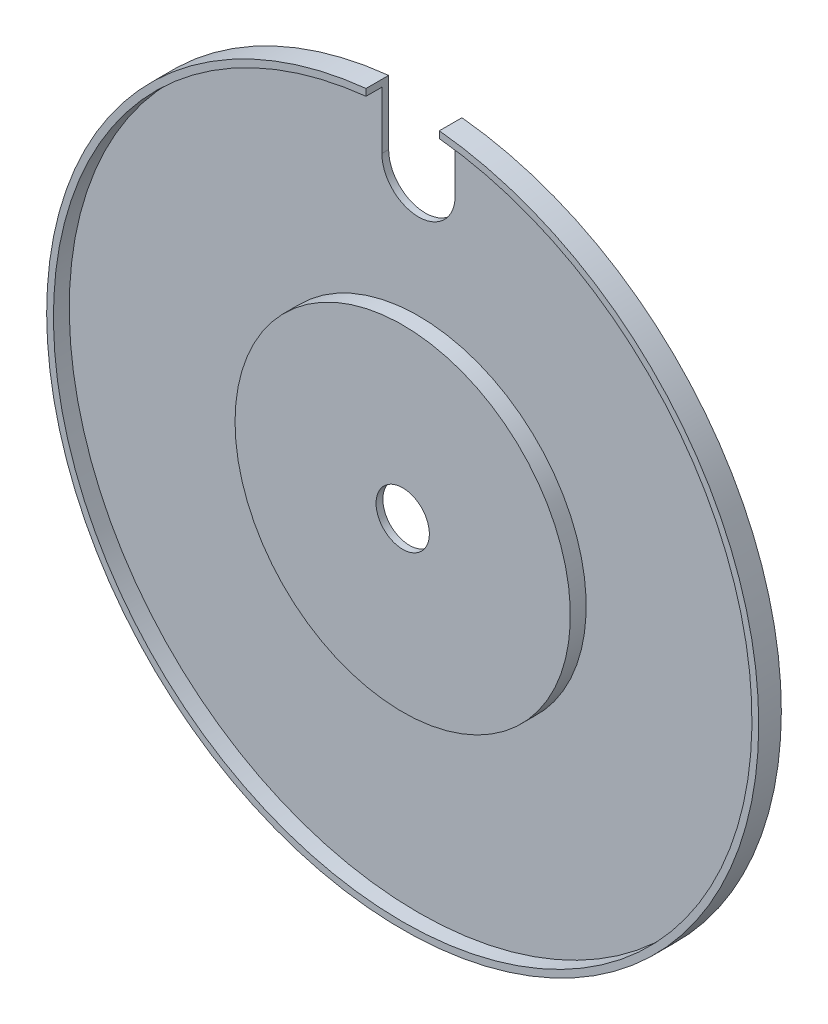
SolidWorks part; units mm, degrees
ref_plane "Front Plane" through (0, 0, 0) normal (0, 0, 1) x (1, 0, 0)
ref_plane "Top Plane" through (0, 0, 0) normal (0, 1, 0) x (1, 0, 0)
ref_plane "Right Plane" through (0, 0, 0) normal (1, 0, 0) x (0, 0, -1)
sketch "Sketch1" plane through (0, 0, 0) normal (0, 0, 1) x (1, 0, 0)
  line L0 (0, 32.5772) -> (0, 0) construction
  line L1 (-4.1185, 32.5772) -> (-4.1185, 44.8616)
  line L2 (-4.1185, 44.8616) -> (4.1185, 44.8616)
  line L3 (4.1185, 44.8616) -> (4.1185, 32.5772)
  circle A0 centre (0, 0) radius 40.005 construction
  circle A1 centre (0, 0) radius 2.9925
  arc A3 (-4.1185, 32.5772) -> (4.1185, 32.5772) centre (0, 32.5772) ccw
  dimension "D2" = 80.01
  dimension "D1" = 32.5772
sketch "Sketch2" plane through (0, 0, 0) normal (0, 1, 0) x (1, 0, 0)
  line L0 (-18.077, -1.1732) -> (0, -1.1732)
  line L1 (-18.077, 0.6048) -> (-18.077, -1.1732)
  line L2 (-40.005, 0.6048) -> (-40.005, -1.9352)
  line L3 (-40.005, -1.9352) -> (-18.077, -1.9352)
  line L4 (0, -1.1732) -> (0, -1.9352)
  line L5 (0, -1.9352) -> (-18.077, -1.9352)
  line L9 (-18.077, 0.6048) -> (-40.005, 0.6048)
  dimension "D1" = 2.54
revolve "Revolve2" add sketch "Sketch2" angle 360 about L4
shell "Shell1" thickness 0.762
extrude "Cut-Extrude5" cut sketch "Sketch1" against normal mid plane 13.716
